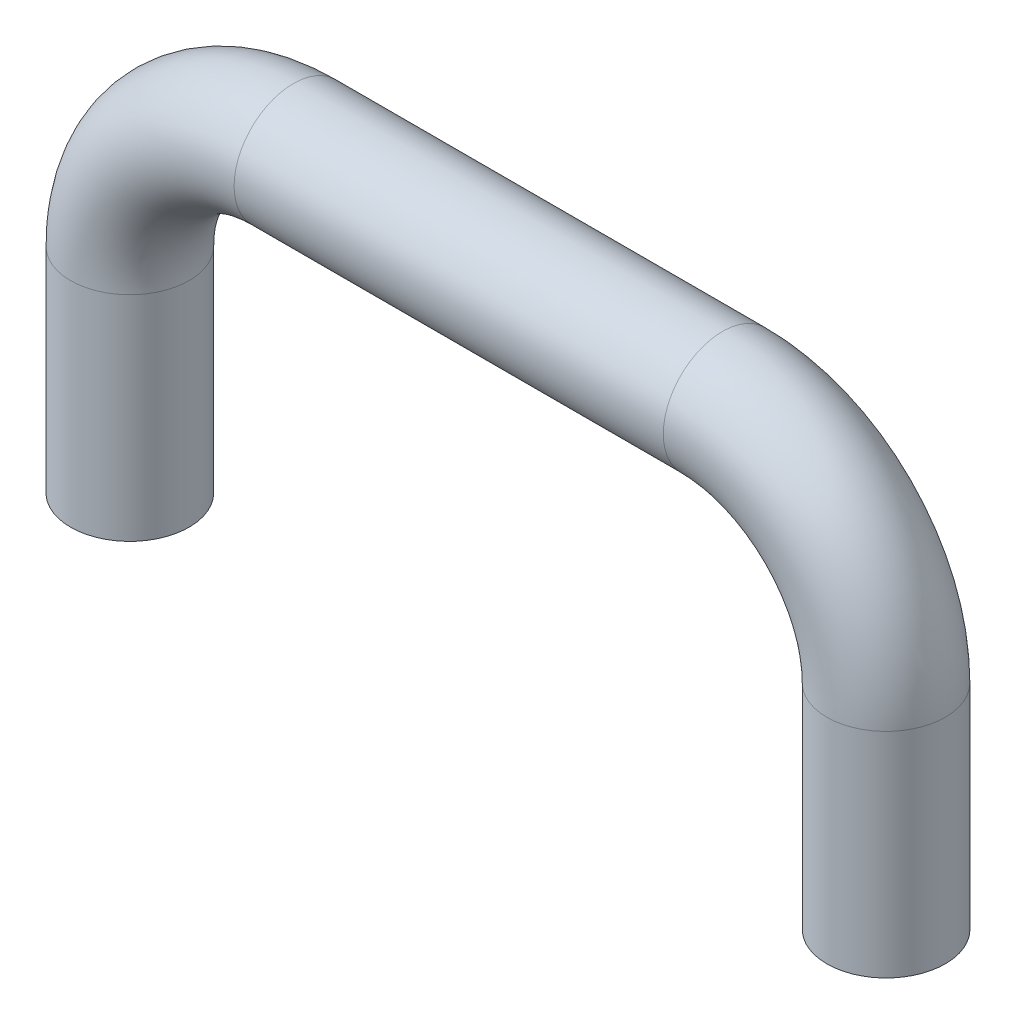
SolidWorks part; units mm, degrees
ref_plane "Plan de face" through (0, 0, 0) normal (0, 0, 1) x (1, 0, 0)
ref_plane "Plan de dessus" through (0, 0, 0) normal (0, 1, 0) x (1, 0, 0)
ref_plane "Plan de droite" through (0, 0, 0) normal (1, 0, 0) x (0, 0, -1)
sketch "Esquisse1" plane through (0, 0, 0) normal (0, 0, 1) x (1, 0, 0)
  line L0 (-44.0096, -145.5841) -> (-44.0096, -41.0841)
  line L1 (35.9904, 38.9159) -> (245.9904, 38.9159)
  line L2 (325.9904, -41.0841) -> (325.9904, -145.5841)
  arc A0 (245.9904, 38.9159) -> (325.9904, -41.0841) centre (245.9904, -41.0841) cw
  arc A1 (35.9904, 38.9159) -> (-44.0096, -41.0841) centre (35.9904, -41.0841) ccw
  point P6 (325.9904, 38.9159)
  point P9 (-44.0096, 38.9159)
  dimension "D4" = 80
  dimension "D1" = 184.5
  dimension "D2" = 184.5
  dimension "D3" = 370
ref_plane "Plan1" through (0, -145.584, 0) normal (0, 1, 0) x (-1, 0, 0)
sketch "Esquisse2" plane through (0, -145.584, 0) normal (0, 1, 0) x (-1, 0, 0)
  circle A0 centre (-325.9904, 0) radius 29
  dimension "D1" = 58
sweep "Balayage1" add profiles "Esquisse2" path "Esquisse1"
sketch "Esquisse3" plane through (0, -145.584, 0) normal (0, -1, 0) x (1, 0, 0)
  circle A0 centre (325.9904, 0) radius 15
  circle A1 centre (-44.0096, 0) radius 15
  dimension "D1" = 30
extrude "Enlèv. mat.-Extru.3" cut sketch "Esquisse3" against normal blind 30
sketch "Esquisse5" plane through (0, -145.5842, 0) normal (0, -1, 0) x (1, 0, 0)
  circle A0 centre (-44.0096, 0) radius 15
  dimension "D1" = 30
extrude "Enlèv. mat.-Extru.4" cut sketch "Esquisse5" against normal blind 30
